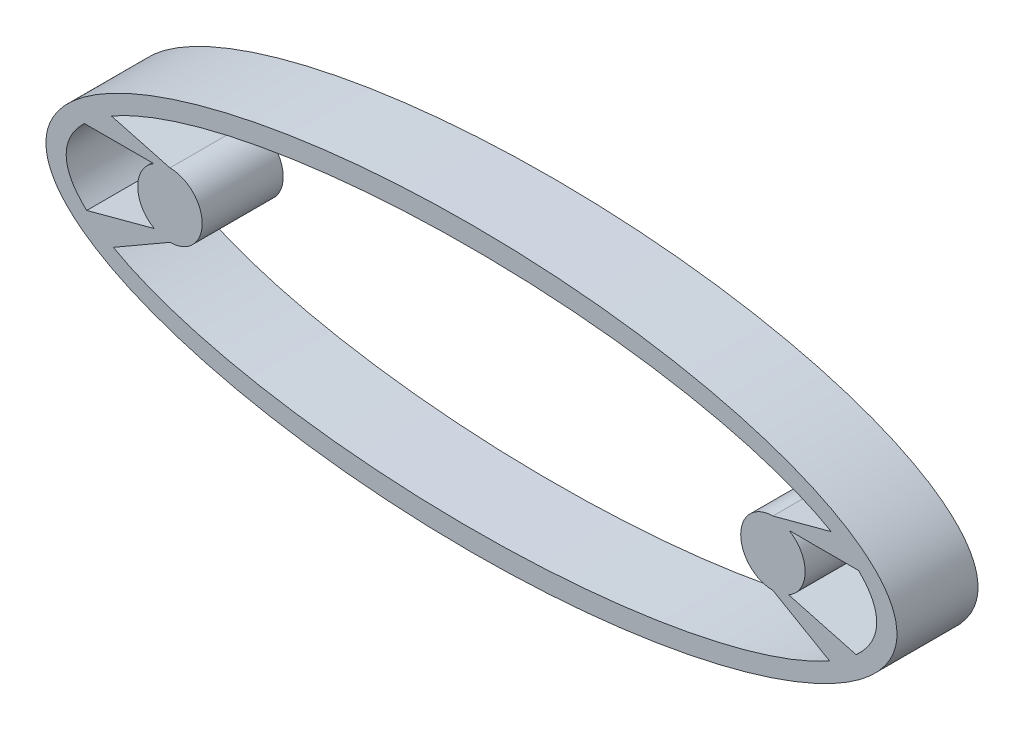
SolidWorks part; units mm, degrees
ref_plane "Front Plane" through (0, 0, 0) normal (0, 0, 1) x (1, 0, 0)
ref_plane "Top Plane" through (0, 0, 0) normal (0, 1, 0) x (1, 0, 0)
ref_plane "Right Plane" through (0, 0, 0) normal (1, 0, 0) x (0, 0, -1)
sketch "Sketch3" plane through (0, 0, 0) normal (0, 0, 1) x (1, 0, 0)
  line L0 (-48.1782, -4.9076) -> (-39.1337, -2.4842)
  line L1 (-39.198, 4.4257) -> (-48.1745, 4.4257)
  line L2 (-37.198, -2.9871) -> (-44.1847, -7.021)
  line L3 (-37.198, 4.9653) -> (-44.403, 6.8959)
  line L4 (0, -15) -> (0, -15.5954)
  line L5 (37.198, -2.9871) -> (44.1847, -7.021)
  line L6 (37.198, 4.9653) -> (44.403, 6.8959)
  line L7 (39.198, 4.4257) -> (48.1745, 4.4257)
  line L8 (48.1782, -4.9076) -> (39.1337, -2.4842)
  arc A0 (-37.198, -2.9871) -> (-37.198, 4.9653) centre (-37.198, 0.9891) ccw
  arc A1 (-39.198, 4.4257) -> (-39.1337, -2.4842) centre (-37.198, 0.9891) ccw
  arc A2 (37.198, -2.9871) -> (37.198, 4.9653) centre (37.198, 0.9891) cw
  arc A3 (39.198, 4.4257) -> (39.1337, -2.4842) centre (37.198, 0.9891) cw
  ellipse E0 centre (0, 0) end of major axis (52.5, 0) minor radius 17.5
  ellipse E1 centre (0, 0) end of major axis (50, 0) minor radius 15 (-47.7742, 4.4257) -> (-47.4642, -4.7163) ccw
  ellipse E2 centre (0, 0) end of major axis (50, 0) minor radius 15 (-44.1847, -7.021) -> (44.1847, -7.021) ccw
  ellipse E3 centre (0, 0) end of major axis (-50, 0) minor radius 15 (47.7742, 4.4257) -> (47.4642, -4.7163) cw
  ellipse E4 centre (0, 0) end of major axis (50, 0) minor radius 15 (44.403, 6.8959) -> (-44.403, 6.8959) ccw
  ellipse E5 centre (0, 0) end of major axis (50, 0) minor radius 15 (47.4642, -4.7163) -> (47.7742, 4.4257) ccw
  dimension "D1" = 105
  dimension "D2" = 35
  dimension "D3" = 100
  dimension "D4" = 30
  dimension "D5" = 15
  dimension "D6" = 15
  dimension "D7" = 15
  dimension "D8" = 2
  dimension "D9" = 2
extrude "Boss-Extrude1" add sketch "Sketch3" along normal blind 10 contours L6 E4 L3 A0 L2 E2 L5 A2 | E3 L7 A3 L8 | L1 E1 L0 A1 | E0
